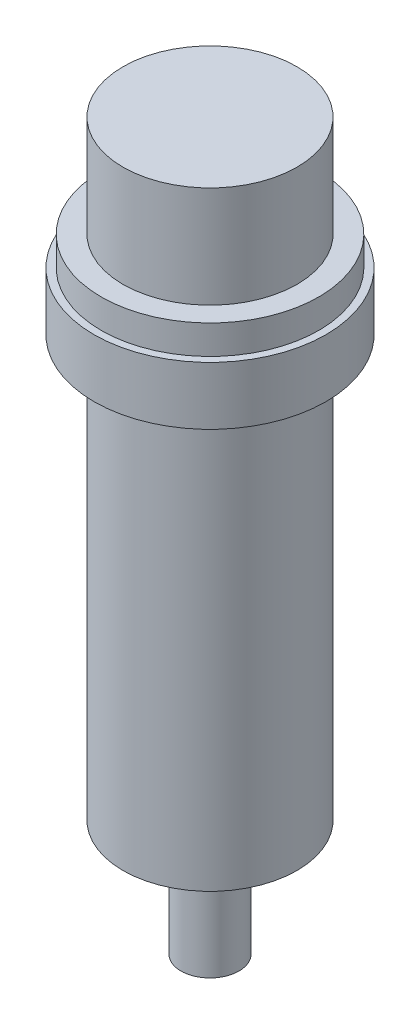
SolidWorks part; units mm, degrees
ref_plane "Спереди" through (0, 0, 0) normal (0, 0, 1) x (1, 0, 0)
ref_plane "Сверху" through (0, 0, 0) normal (0, 1, 0) x (1, 0, 0)
ref_plane "Справа" through (0, 0, 0) normal (1, 0, 0) x (0, 0, -1)
sketch "Эскиз1" plane through (0, 0, 0) normal (0, 1, 0) x (1, 0, 0)
  circle A0 centre (0, 0) radius 8
extrude "Бобышка-Вытянуть1" add sketch "Эскиз1" along normal blind 4
sketch "Эскиз2" plane through (0, 4, 0) normal (0, 1, 0) x (1, 0, 0)
  circle A0 centre (0, 0) radius 7.5
extrude "Бобышка-Вытянуть2" add sketch "Эскиз2" along normal blind 2
sketch "Эскиз3" plane through (0, 6, 0) normal (0, 1, 0) x (1, 0, 0)
  circle A0 centre (0, 0) radius 6
extrude "Бобышка-Вытянуть3" add sketch "Эскиз3" along normal blind 7
sketch "Эскиз4" plane through (0, 0, 0) normal (0, -1, 0) x (1, 0, 0)
  circle A0 centre (0, 0) radius 6
extrude "Бобышка-Вытянуть4" add sketch "Эскиз4" along normal blind 29
sketch "Эскиз5" plane through (0, -29, 0) normal (0, -1, 0) x (1, 0, 0)
  circle A0 centre (0, 0) radius 2
extrude "Бобышка-Вытянуть5" add sketch "Эскиз5" along normal blind 8
